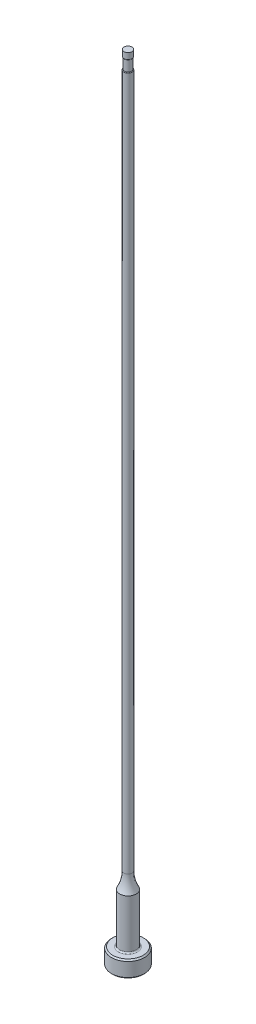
SolidWorks part; units mm, degrees
ref_plane "Front Plane" through (0, 0, 0) normal (0, 0, 1) x (1, 0, 0)
ref_plane "Top Plane" through (0, 0, 0) normal (0, 1, 0) x (1, 0, 0)
ref_plane "Right Plane" through (0, 0, 0) normal (1, 0, 0) x (0, 0, -1)
other "Configuration Table"
sketch "Sketch1" plane through (0, 0, 0) normal (0, 0, 1) x (1, 0, 0)
  line L0 (0, 259.9588) -> (0, -15.1925) construction
  line L1 (0, 0) -> (-3.175, 0)
  line L2 (-3.175, 0) -> (-3.175, 3.175)
  line L3 (-3.175, 3.175) -> (-1.5875, 3.175)
  line L4 (-0.7937, 15.7742) -> (-0.7937, 152.4)
  line L5 (-0.7937, 152.4) -> (0, 152.4)
  line L6 (0, 152.4) -> (0, 0)
  line L7 (-1.5875, 3.175) -> (-1.5875, 12.7)
  arc A1 (-1.5875, 12.7) -> (-0.7937, 15.7742) centre (-7.1437, 15.7742) ccw
  dimension "D1" = 6.35
  dimension "L" = 152.4
  dimension "D2" = 3.175
  dimension "H" = 6.35
  dimension "T" = 3.175
  dimension "D" = 1.5875
  dimension "S" = 12.7
revolve "Revolve1" add sketch "Sketch1" angle 360 about L0
chamfer "Chamfer1" distance 0.254 angle 45 2 edges at (0, 3.175, 3.175) (0, 0, 3.175)
fillet "Fillet1" radius 0.254 1 edges at (0, 3.175, 1.5875)
sketch "Sketch2" plane through (0, 0, 0) normal (0, 0, 1) x (1, 0, 0)
  line L0 (-0.7937, 152.4) -> (-0.7937, 15.7742) construction
  line L1 (-0.7937, 151.13) -> (-0.6921, 151.13)
  line L2 (-0.7937, 151.13) -> (-0.7937, 149.098)
  line L3 (-0.7937, 149.098) -> (-0.6921, 149.098)
  line L4 (-0.6921, 151.13) -> (-0.6921, 149.098)
  line L5 (0.7937, 152.4) -> (-0.7937, 152.4) construction
  line L6 (0, 153.4483) -> (0, 147.3282) construction
  dimension "D1" = 2.032
  dimension "N" = 1.27
  dimension "FD" = 0.1016
  dimension "D3" = 1.3843
revolve "Vent Relief" cut sketch "Sketch2" angle 360 about L6
sketch "Sketch3" plane through (0, 0, 0) normal (0, 0, 1) x (1, 0, 0)
  line L0 (-0.6921, 150.114) -> (-0.6921, 112.014)
  line L1 (-0.6921, 151.13) -> (-0.6921, 149.098) construction
  line L2 (-0.7937, 149.098) -> (-0.7937, 15.7742) construction
  line L3 (-0.7937, 111.2172) -> (-0.7937, 150.114)
  line L4 (-0.7937, 150.114) -> (-0.6921, 150.114)
  arc A0 (-0.6921, 112.014) -> (-0.7937, 111.2172) centre (-3.8671, 112.014) cw
  dimension "D1" = 3.175
  dimension "D2" = 38.1
extrude "D-Slot" cut sketch "Sketch3" against normal through all both and the other way through all
sketch "Sketch5" plane through (0, 0, 0) normal (0, 0, 1) x (1, 0, 0)
  line L0 (-0.7937, 151.13) -> (0.7937, 151.13) construction
  line L1 (-0.7937, 152.4) -> (-0.7747, 152.4)
  line L2 (-0.7937, 152.4) -> (-0.7937, 151.13)
  line L3 (-0.7937, 151.13) -> (-0.7747, 151.13)
  line L4 (-0.7747, 152.4) -> (-0.7747, 151.13)
  line L5 (0, 152.6877) -> (0, 150.5771) construction
  dimension "VP" = 0.019
revolve "Vent Diameter" cut sketch "Sketch5" angle 360 about L5
fillet "Fillet2" radius 0.127 2 edges at (0.7937, 149.098, 0) (0, 151.13, 0.7747)
sketch "Pocket Sketch" plane through (0, 0, 0) normal (0, 0, 1) x (1, 0, 0)
  line L0 (-3.5719, 0) -> (-3.5719, 3.2004)
  line L1 (-3.5719, 3.2004) -> (-1.7542, 3.2004)
  line L2 (-0.9922, 3.9624) -> (-0.9922, 22.225)
  line L3 (-0.9922, 22.225) -> (0, 22.225)
  line L4 (0, 22.225) -> (0, 0)
  line L5 (0, 0) -> (-3.5719, 0)
  line L6 (0, 12.6104) -> (0, -2.4989) construction
  line L7 (-3.175, 2.921) -> (-3.175, 0.254) construction
  line L8 (2.921, 3.175) -> (-2.921, 3.175) construction
  line L9 (-0.7937, 111.2172) -> (-0.7937, 15.7742) construction
  line L10 (-1.7542, 3.2004) -> (-0.9922, 3.9624)
  point P3 (-0.9922, 3.2004)
  dimension "D1" = 7.1437
  dimension "D2" = 0.3969
  dimension "D3" = 0.0254
  dimension "D4" = 0.1984
  dimension "D5" = 1.9844
  dimension "D6" = 22.225
